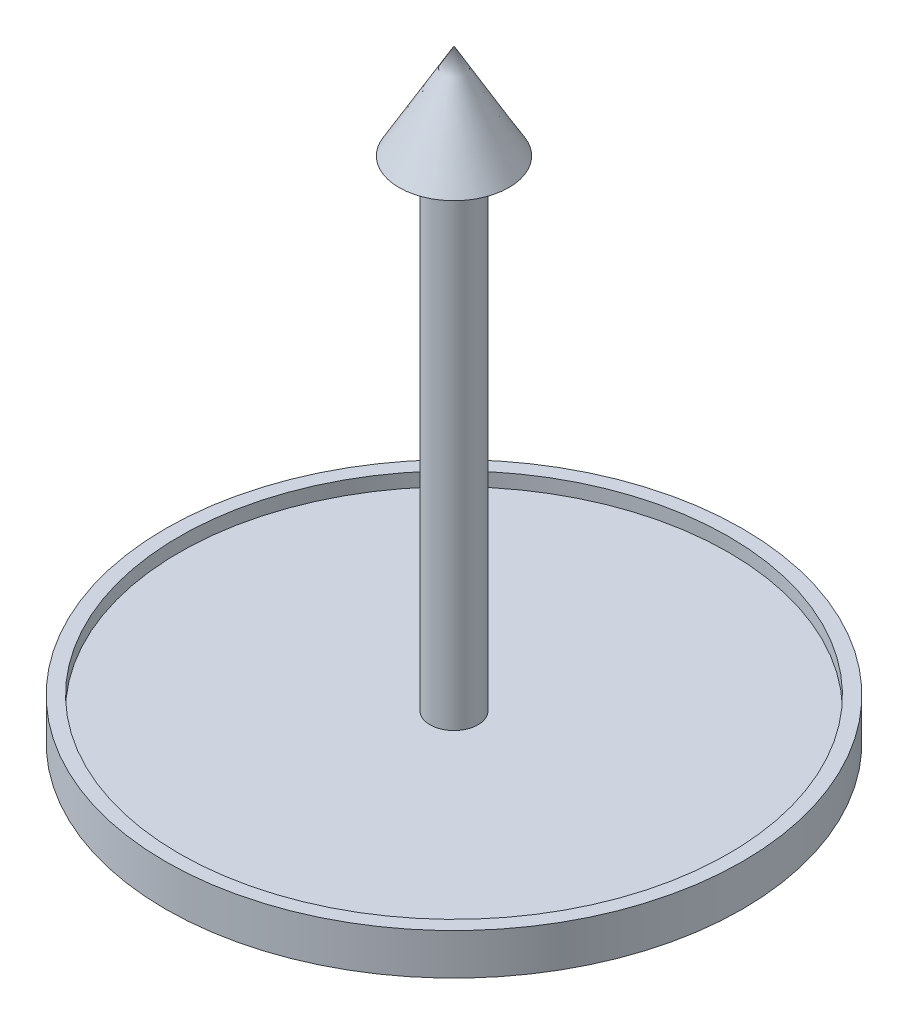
SolidWorks part; units mm, degrees
ref_plane "Face" through (0, 0, 0) normal (0, 0, 1) x (1, 0, 0)
ref_plane "Dessus" through (0, 0, 0) normal (0, 1, 0) x (1, 0, 0)
ref_plane "Droite" through (0, 0, 0) normal (1, 0, 0) x (0, 0, -1)
sketch "Esquisse1" plane through (0, 0, 0) normal (0, 0, 1) x (1, 0, 0)
  line L0 (0, 70.5787) -> (0, -41.6233) construction
  line L1 (0, 0) -> (-40, 0)
  line L2 (-40, 0) -> (-40, -2)
  line L3 (-40, -2) -> (-42, -2)
  line L4 (-42, -2) -> (-42, 4)
  line L5 (-42, 4) -> (-40, 4)
  line L6 (-40, 4) -> (-40, 2)
  line L7 (-40, 2) -> (-3.5, 2)
  line L8 (-3.5, 2) -> (-3.5, 72)
  line L9 (-3.5, 72) -> (-8, 72)
  line L10 (-8, 72) -> (0, 85.8564)
  line L11 (0, 0) -> (0, 85.8564)
  dimension "D1" = 42
  dimension "D2" = 2
  dimension "D3" = 2
  dimension "D4" = 2
  dimension "D5" = 2
  dimension "D6" = 2
  dimension "D7" = 3.5
  dimension "D8" = 70
  dimension "D9" = 8
  dimension "D10" = 60
revolve "Révolution1" add sketch "Esquisse1" angle 360 about L0
